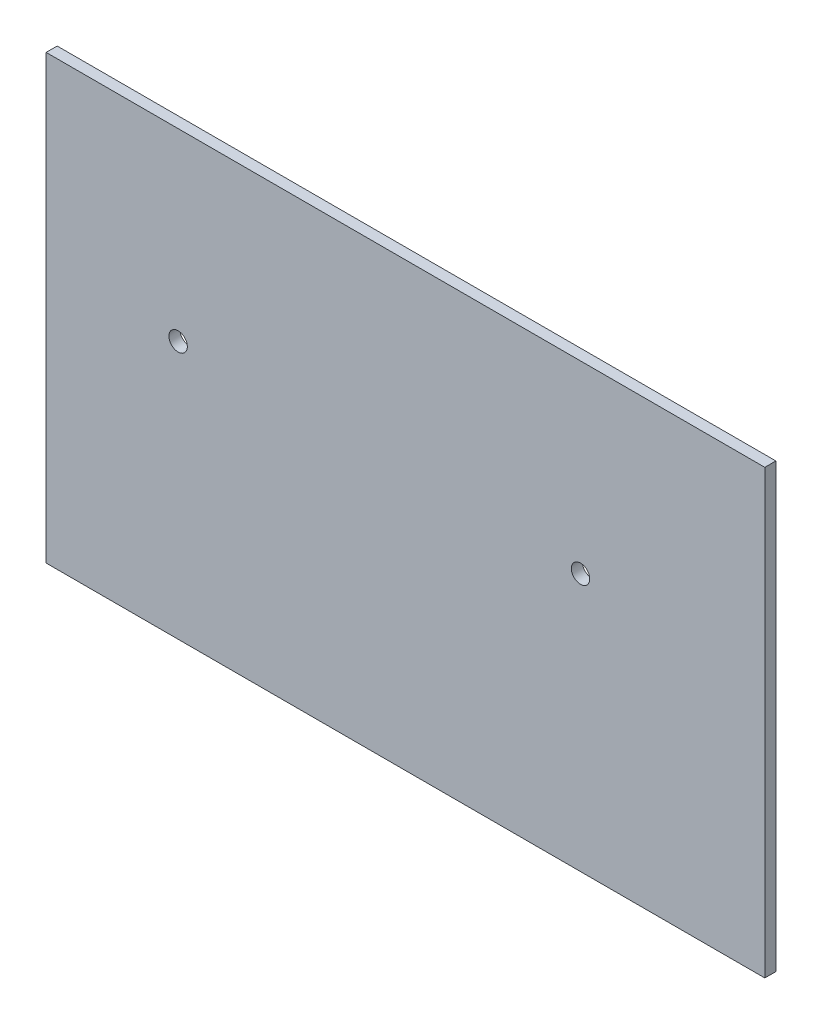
SolidWorks part; units mm, degrees
ref_plane "Plan de face" through (0, 0, 0) normal (0, 0, 1) x (1, 0, 0)
ref_plane "Plan de dessus" through (0, 0, 0) normal (0, 1, 0) x (1, 0, 0)
ref_plane "Plan de droite" through (0, 0, 0) normal (1, 0, 0) x (0, 0, -1)
sketch "Esquisse1" plane through (0, 0, 0) normal (0, 0, 1) x (1, 0, 0)
  line L1 (-75.7745, 50.7636) -> (119.2255, 50.7636)
  line L2 (-75.7745, 50.7636) -> (-75.7745, -69.2364)
  line L3 (-75.7745, -69.2364) -> (119.2255, -69.2364)
  line L4 (119.2255, 50.7636) -> (119.2255, -69.2364)
  dimension "D1" = 195
  dimension "D2" = 120
extrude "Extrusion1" add sketch "Esquisse1" along normal blind 3
sketch "Esquisse2" plane through (0, 0, 3) normal (0, 0, 1) x (1, 0, 0)
  line L4 (119.2255, -69.2364) -> (119.2255, 50.7636) construction
  line L6 (119.2255, 50.7636) -> (-75.7745, 50.7636) construction
  circle A0 centre (69.2255, 0.7636) radius 2.5
  circle A2 centre (-39.9648, 0.7636) radius 2.5
  dimension "D1" = 5
  dimension "D2" = 50
  dimension "D3" = 5
  dimension "D4" = 50
  dimension "D5" = 50
extrude "Enlèv. mat.-Extru.1" cut sketch "Esquisse2" against normal through all
